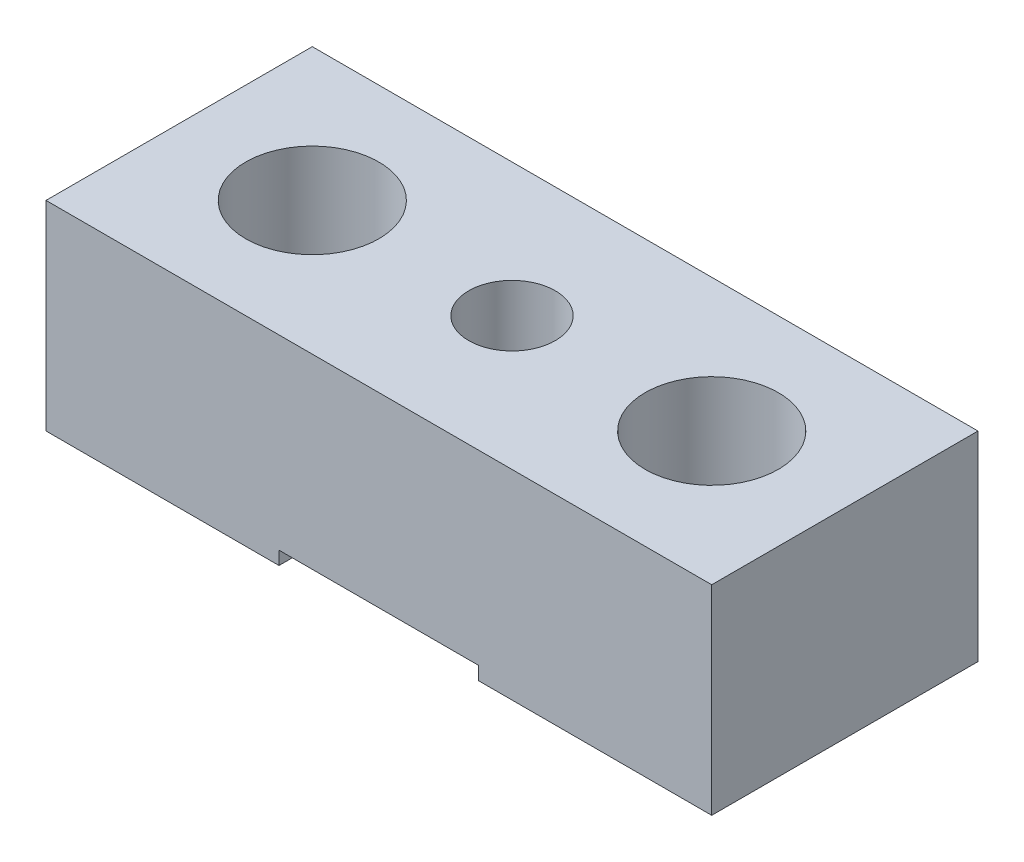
SolidWorks part; units mm, degrees
ref_plane "Plan de face" through (0, 0, 0) normal (0, 0, 1) x (1, 0, 0)
ref_plane "Plan de dessus" through (0, 0, 0) normal (0, 1, 0) x (1, 0, 0)
ref_plane "Plan de droite" through (0, 0, 0) normal (1, 0, 0) x (0, 0, -1)
sketch "Esquisse1" plane through (0, 0, 0) normal (0, 0, 1) x (1, 0, 0)
  line L0 (0, 0) -> (50, 0)
  line L1 (50, 0) -> (50, -15)
  line L2 (32.5, -14) -> (17.5, -14)
  line L3 (17.5, -14) -> (17.5, -15)
  line L4 (17.5, -15) -> (0, -15)
  line L5 (0, -15) -> (0, 0)
  line L6 (32.5, -14) -> (32.5, -15)
  line L7 (32.5, -15) -> (50, -15)
  dimension "D1" = 50
  dimension "D2" = 17.5
  dimension "D3" = 15
  dimension "D4" = 1
  dimension "D5" = 15
extrude "Extrusion1" add sketch "Esquisse1" along normal mid plane 20
sketch "Esquisse2" plane through (0, 0, 0) normal (0, 1, 0) x (-1, 0, 0)
  line L0 (-50, -10) -> (0, -10) construction
  line L1 (0, 10) -> (0, -10) construction
  circle A0 centre (-10, 0) radius 5
  circle A1 centre (-25, 0) radius 3.25
  circle A2 centre (-40, 0) radius 5
  dimension "D5" = 10
  dimension "D6" = 6.5
  dimension "D1" = 10
  dimension "D2" = 10
  dimension "D3" = 15
  dimension "D4" = 15
extrude "Enlèv. mat.-Extru.1" cut sketch "Esquisse2" against normal up to next
